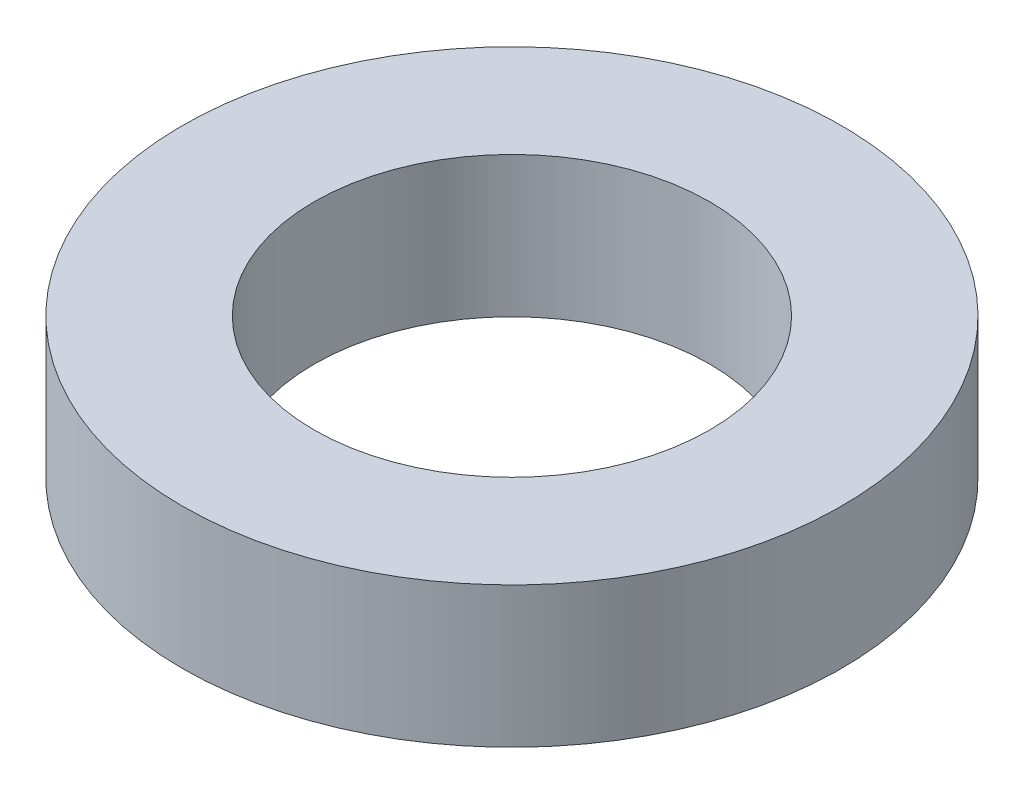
SolidWorks part; units mm, degrees
ref_plane "Front Plane" through (0, 0, 0) normal (0, 0, 1) x (1, 0, 0)
ref_plane "Top Plane" through (0, 0, 0) normal (0, 1, 0) x (1, 0, 0)
ref_plane "Right Plane" through (0, 0, 0) normal (1, 0, 0) x (0, 0, -1)
sketch "Sketch1" plane through (0, 0, 0) normal (0, 1, 0) x (1, 0, 0)
  circle A0 centre (0, 0) radius 23.8125
  circle A1 centre (0, 0) radius 14.2875
  dimension "D1" = 47.625
  dimension "D2" = 28.575
extrude "Boss-Extrude1" add sketch "Sketch1" against normal blind 10.16
